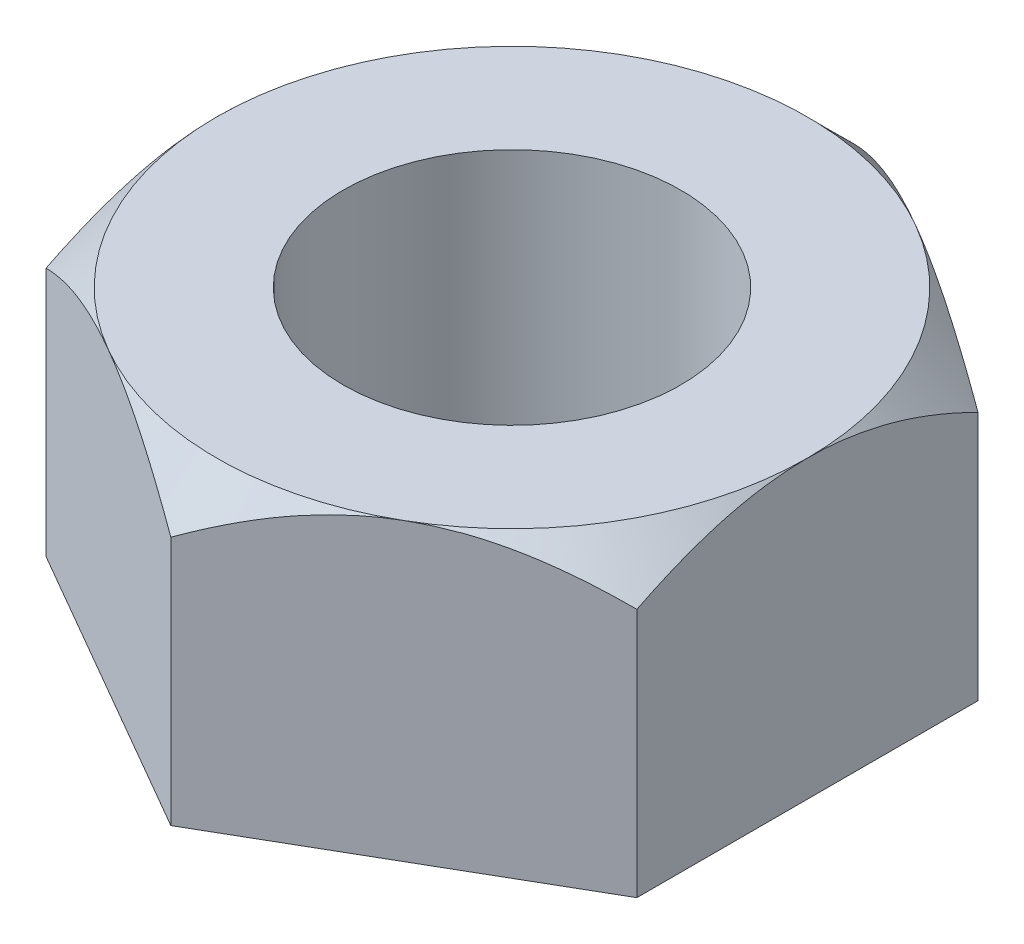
SolidWorks part; units mm, degrees
ref_plane "Front" through (0, 0, 0) normal (0, 0, 1) x (1, 0, 0)
ref_plane "Top" through (0, 0, 0) normal (0, 1, 0) x (1, 0, 0)
ref_plane "Right" through (0, 0, 0) normal (1, 0, 0) x (0, 0, -1)
sketch "Sketch1" plane through (0, 0, 0) normal (0, 1, 0) x (1, 0, 0)
  line L1 (0, 6.4158) -> (-5.5563, 3.2079)
  line L2 (-5.5563, 3.2079) -> (-5.5563, -3.2079)
  line L3 (-5.5563, -3.2079) -> (0, -6.4158)
  line L4 (0, -6.4158) -> (5.5562, -3.2079)
  line L5 (5.5562, -3.2079) -> (5.5562, 3.2079)
  line L6 (5.5562, 3.2079) -> (0, 6.4158)
  circle A0 centre (0, 0) radius 5.5563 construction
extrude "Extrude1" add sketch "Sketch1" along normal blind 5.5562
sketch "Sketch3" plane through (0, 0, 0) normal (1, 0, 0) x (0, 0, -1)
  line L0 (5.5562, 5.5562) -> (6.4158, 4.6967)
  line L1 (3.2079, 5.5562) -> (6.4158, 5.5562) construction
  line L2 (6.4158, 5.5562) -> (6.4158, 0) construction
  line L3 (6.4158, 4.6967) -> (6.4158, 5.5562)
  line L4 (6.4158, 5.5562) -> (5.5562, 5.5562)
  line L5 (0, 0.542) -> (0, -0.542) construction
revolve "Cut-Revolve2" cut sketch "Sketch3" angle 360 about L5
sketch "Sketch2" plane through (0, 0, 0) normal (0, 0, 1) x (1, 0, 0)
  line L0 (0, 1.6636) -> (0, -0.3796) construction
  line L1 (0, 5.5562) -> (2.4876, 5.5562)
  line L3 (0, 5.5562) -> (5.5562, 5.5562) construction
  line L4 (0, 4.2862) -> (2.4876, 4.2862)
  line L5 (2.4876, 5.5562) -> (3.175, 5.1594)
  line L6 (3.175, 5.1594) -> (3.175, 5.0006)
  line L7 (3.175, 5.0006) -> (2.4876, 4.6037)
  line L9 (2.4876, 4.2862) -> (2.4876, 4.6037)
  line L10 (0, 4.2862) -> (0, 5.5562)
  line L11 (2.4876, 5.5562) -> (2.4876, 4.6037) construction
  line L12 (3.175, 5.08) -> (2.4876, 5.08) construction
revolve "Cut-Revolve1" [suppressed] cut sketch "Sketch2" angle 360 about L0
pattern_linear "LPattern2" [suppressed] count 5 spacing 1.27 along (0, -1, 0)
chamfer "Chamfer1" [suppressed] distance 0.635 angle 45
sketch "Sketch4" plane through (0, 5.5562, 0) normal (0, 1, 0) x (1, 0, 0)
  circle A0 centre (0, 0) radius 3.175
  dimension "D1" = 6.35
extrude "Cut-Extrude1" cut sketch "Sketch4" against normal through all
equation "\"D5@Sketch2\"=\"Pitch@Sketch2\"/8"
equation "\"D2@Sketch2\"=\"Pitch@Sketch2\"/4"
equation "\"D3@LPattern2\"=\"Pitch@Sketch2\""
equation "\"D1@LPattern2\"=int(\"Height@Extrude1\"/\"Pitch@Sketch2\")+1"
equation "\"D2@Sketch3\"=\"Hex Flats@Sketch1\""
equation "\"D1@Chamfer1\"=\"Pitch@Sketch2\"/2"
